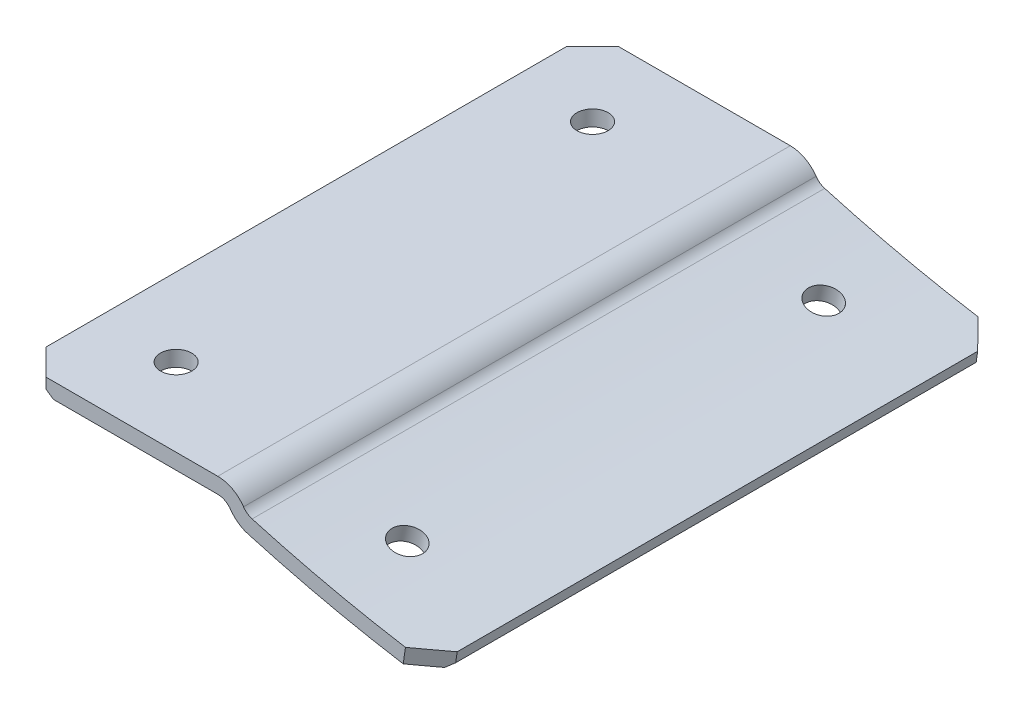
SolidWorks part; units mm, degrees
ref_plane "Plan de face" through (0, 0, 0) normal (0, 0, 1) x (1, 0, 0)
ref_plane "Plan de dessus" through (0, 0, 0) normal (0, 1, 0) x (1, 0, 0)
ref_plane "Plan de droite" through (0, 0, 0) normal (1, 0, 0) x (0, 0, -1)
sketch "Esquisse1" plane through (0, 0, 0) normal (0, 0, 1) x (1, 0, 0)
  line L1 (43.45, 0) -> (-43.45, 0) construction
  line L2 (-15, 0) -> (23, 0)
  arc A0 (29.6, -3.8) -> (64, -11.2) centre (101.7337, 247.8677) ccw
  arc A1 (23, 0) -> (27.9511, -2.6107) centre (23, -6) cw
  arc A2 (29.6, -3.8) -> (27.9511, -2.6107) centre (30.4266, -0.9161) cw
  point P2 (64, -11.2)
  dimension "D2" = 29.6
  dimension "D5" = 23
  dimension "D8" = 6
  dimension "D9" = 3
  dimension "D4" = 15
  dimension "D6" = 64
  dimension "D7" = 11.2
  dimension "D10" = 3.8
extrude "Extru.-Mince1" add sketch "Esquisse1" along normal blind 55 thin
sketch "Esquisse4" plane through (0, 0, 0) normal (0, 1, 0) x (1, 0, 0)
  line L0 (-7.7126, 0) -> (7.7126, 0) construction
  circle A0 centre (0, -40) radius 3
  dimension "D1" = 6
  dimension "D2" = 40
extrude "Extrusion1" cut sketch "Esquisse4" against normal through all
ref_plane "Plan1" through (-1.3366, -6.0291, 0) normal (0.2164, 0.9763, 0) x (-0.9763, 0.2164, 0)
sketch "Esquisse2" plane through (-1.3366, -6.0291, 0) normal (0.2164, 0.9763, 0) x (-0.9763, 0.2164, 0)
  line L0 (7.7126, 0) -> (-7.7126, 0) construction
  circle A0 centre (-45, 40) radius 3
  dimension "D2" = 6
  dimension "D3" = 45
  dimension "D4" = 40
extrude "Extrusion2" cut sketch "Esquisse2" along normal through all
chamfer "Chanfrein1" distance 5 angle 45 2 edges at (-15, -1.5, 55) (63.7838, -12.6843, 55)
chamfer "Chanfrein2" distance 1 angle 45 3 edges at (-12.5, -3, 52.5) (-15, -3, 25) (63.5676, -14.1687, 25)
mirror "Symétrie1" about plane through (0, 0, 0) normal (0, 0, 1)
